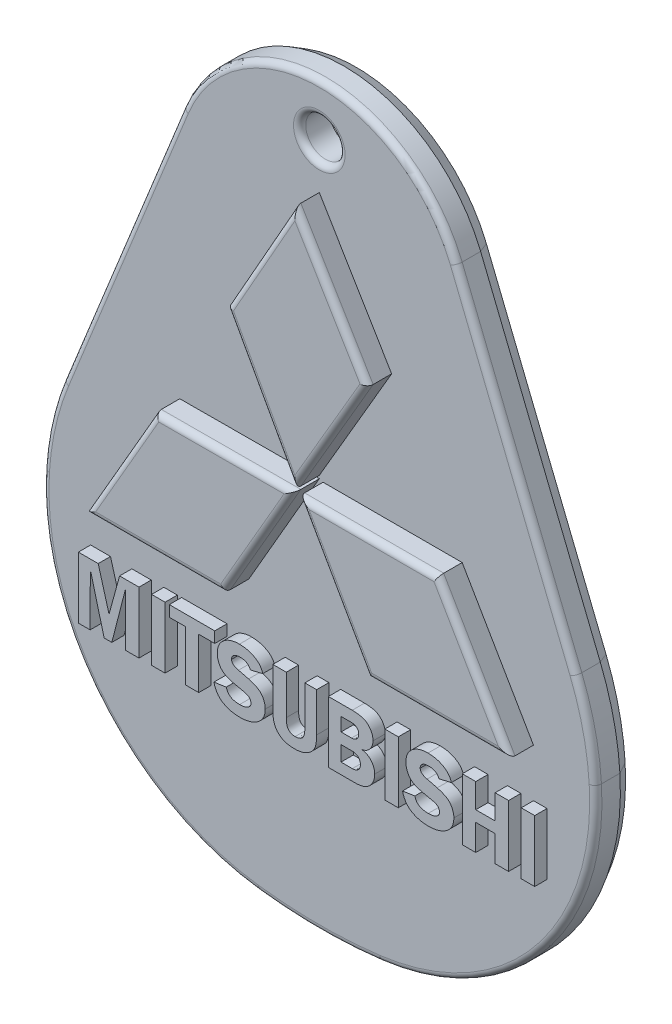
SolidWorks part; units mm, degrees
ref_plane "Front Plane" through (0, 0, 0) normal (0, 0, 1) x (1, 0, 0)
ref_plane "Top Plane" through (0, 0, 0) normal (0, 1, 0) x (1, 0, 0)
ref_plane "Right Plane" through (0, 0, 0) normal (1, 0, 0) x (0, 0, -1)
sketch "Sketch1" plane through (0, 0, 0) normal (0, 0, 1) x (1, 0, 0)
  line L0 (11.1243, 24.5) -> (20.8581, 0.4375)
  line L1 (-11.1243, 24.5) -> (-20.8581, 0.4375)
  arc A0 (-20.8581, 0.4375) -> (-22.456, -6.5937) centre (0, -8) ccw
  arc A1 (11.1243, 24.5) -> (-11.1243, 24.5) centre (0, 20) ccw
  arc A2 (22.456, -6.5937) -> (20.8581, 0.4375) centre (0, -8) ccw
  arc A3 (-4.9902, -27.6875) -> (4.9902, -27.6875) centre (0, 12) ccw
  arc A4 (-4.9902, -27.6875) -> (-22.456, -6.5937) centre (-2.4951, -7.8438) cw
  arc A5 (4.9902, -27.6875) -> (22.456, -6.5937) centre (2.4951, -7.8438) ccw
  point P12 (-14.3333, -25.3438)
  point P15 (14.3333, -25.3438)
  dimension "D1" = 28
  dimension "D2" = 24
  dimension "D3" = 45
  dimension "D6" = 40
  dimension "D7" = 20
  dimension "D4" = 8
  dimension "D5" = 20
extrude "Extrude1" add sketch "Sketch1" against normal blind 3
sketch "Sketch2" plane through (0, 0, 0) normal (0, 0, 1) x (1, 0, 0)
  line L0 (0, 4.1601) -> (-5.555, 14.2584)
  line L1 (-5.555, 14.2584) -> (0, 24.088)
  line L2 (0, 24.088) -> (5.8861, 14.2584)
  line L3 (5.8861, 14.2584) -> (0, 4.1601)
extrude "Extrude2" add sketch "Sketch2" along normal blind 2
sketch "Sketch3" plane through (0, 0, 0) normal (0, 0, 1) x (1, 0, 0)
  line L0 (0, 3.9258) -> (-5.7317, -6.0062)
  line L1 (-5.7317, -6.0062) -> (-17.0564, -6.0062)
  line L2 (-17.0564, -6.0062) -> (-11.349, 3.8837)
  line L3 (-11.349, 3.8837) -> (0, 3.9258)
extrude "Extrude3" add sketch "Sketch3" along normal blind 2
sketch "Sketch4" plane through (0, 0, 0) normal (0, 0, 1) x (1, 0, 0)
  line L0 (0.3058, 3.8318) -> (11.6222, 3.8318)
  line L1 (11.6222, 3.8318) -> (17.4214, -6.1366)
  line L2 (17.4214, -6.1366) -> (5.964, -6.1366)
  line L3 (5.964, -6.1366) -> (0.3058, 3.8318)
extrude "Extrude4" add sketch "Sketch4" along normal blind 2
fillet "Fillet1" radius 0.5 12 edges at (2.9431, 9.2093, 2) (2.9431, 19.1732, 2) (-2.7775, 19.1732, 2) (-2.7775, 9.2093, 2) (-11.394, -6.0062, 2) (-2.8658, -1.0402, 2) (-5.6745, 3.9048, 2) (-14.2027, -1.0612, 2) (3.1349, -1.1524, 2) (11.6927, -6.1366, 2) (14.5218, -1.1524, 2) (5.964, 3.8318, 2)
sketch "Sketch5" plane through (0, 0, 0) normal (0, 0, 1) x (1, 0, 0)
  text T0 "MITSUBISHI" font "Franklin Gothic Medium" height 5
extrude "Extrude5" add sketch "Sketch5" along normal blind 1
sketch "Sketch6" plane through (0, 0, 0) normal (0, 0, 1) x (1, 0, 0)
  circle A0 centre (0, 27.7777) radius 1.6
extrude "Cut-Extrude1" cut sketch "Sketch6" against normal through all
fillet "Fillet2" radius 0.5 9 edges at (1.6, 27.7777, 0) (15.9912, 12.4687, 0) (21.9405, -3.0137, 0) (17.8998, -20.599, 0) (0, -28, 0) (-17.8998, -20.599, 0) (-21.9405, -3.0137, 0) (-15.9912, 12.4687, 0) (0, 32, 0)
chamfer "Chamfer1" distance 1 angle 30 9 edges at (-21.9405, -3.0137, -3) (-17.8998, -20.599, -3) (0, -28, -3) (17.8998, -20.599, -3) (21.9405, -3.0137, -3) (15.9912, 12.4687, -3) (1.6, 27.7777, -3) (0, 32, -3) (-15.9912, 12.4687, -3)
